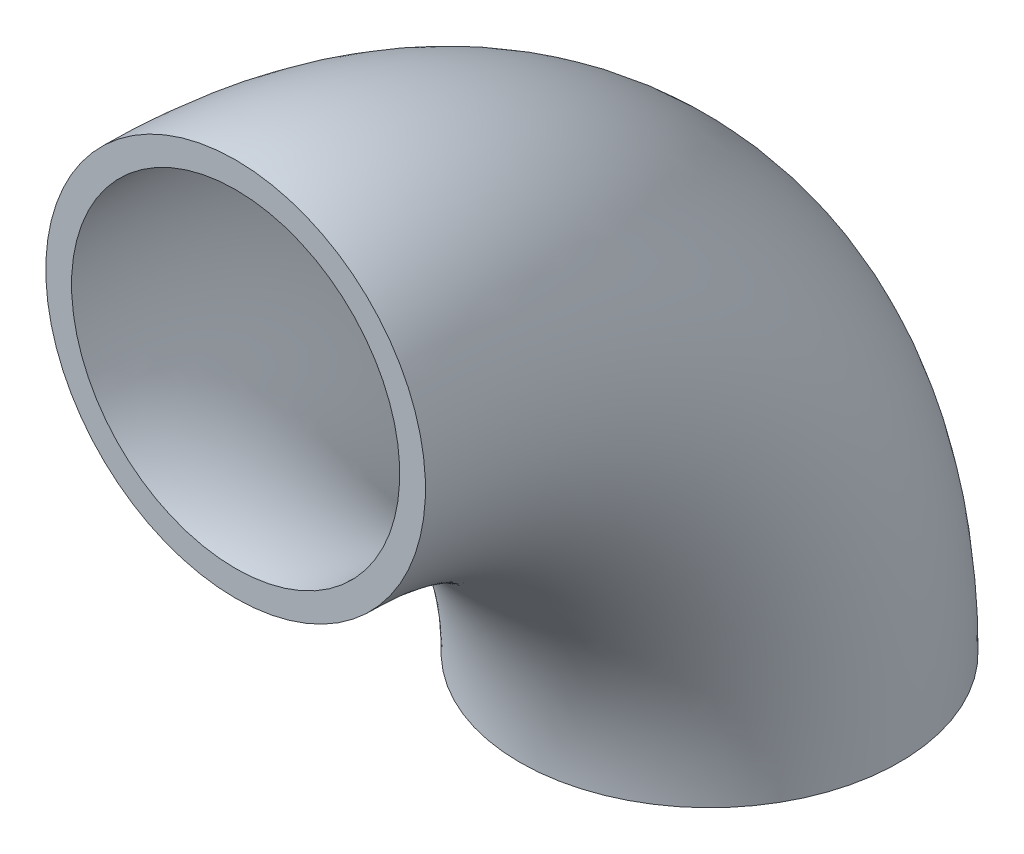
SolidWorks part; units mm, degrees
ref_plane "Plan de face" through (0, 0, 0) normal (0, 0, 1) x (1, 0, 0)
ref_plane "Plan de dessus" through (0, 0, 0) normal (0, 1, 0) x (1, 0, 0)
ref_plane "Plan de droite" through (0, 0, 0) normal (1, 0, 0) x (0, 0, -1)
sketch "Esquisse1" plane through (0, 0, 0) normal (0, 0, 1) x (1, 0, 0)
  circle A0 centre (0, 0) radius 32.89
  circle A1 centre (0, 0) radius 38.05
  dimension "D1" = 65.78
  dimension "D2" = 76.1
sketch "Esquisse2" plane through (0, 0, 0) normal (1, 0, 0) x (0, 0, -1)
  line L1 (77.4807, -95) -> (-85.8033, -95) construction
  arc A0 (95, -95) -> (0, 0) centre (0, -95) ccw
  dimension "D1" = 95
sweep "Balayage2" add profiles "Esquisse1" path "Esquisse2"
